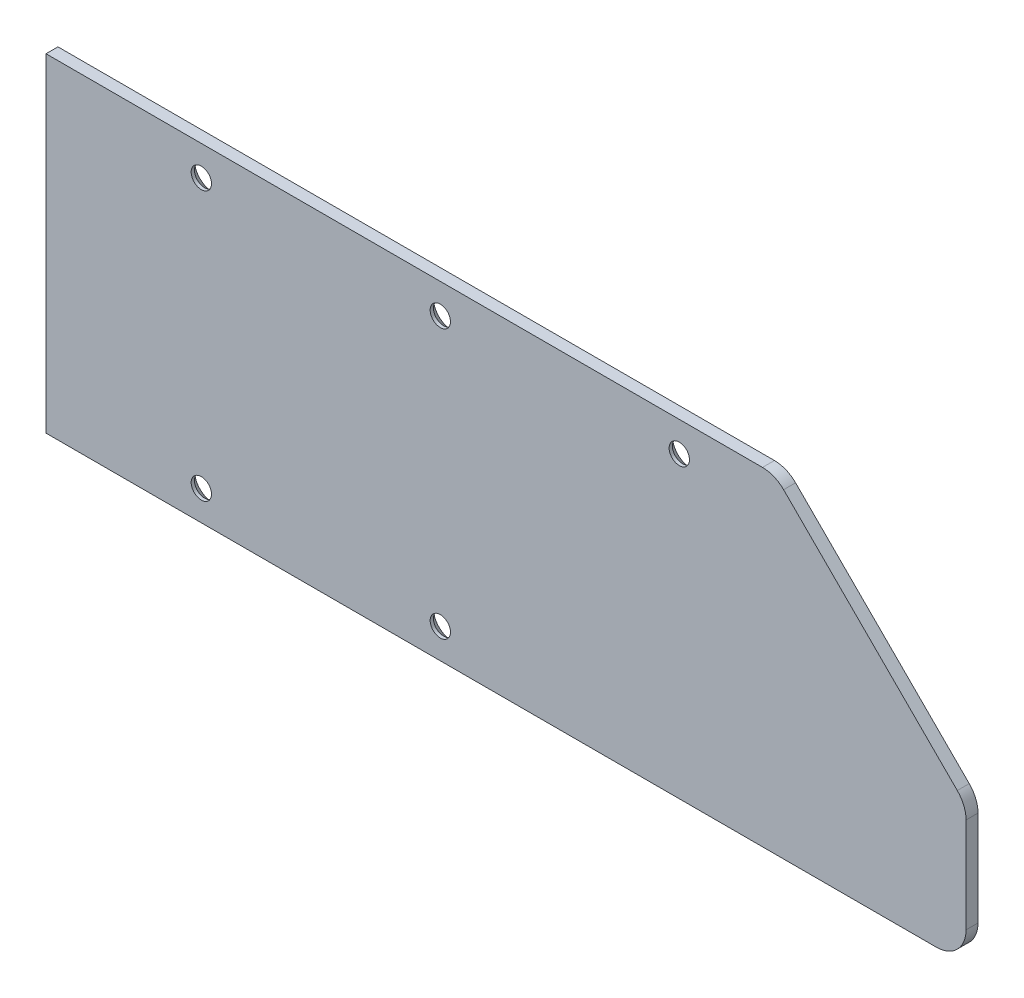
SolidWorks part; units mm, degrees
ref_plane "Face" through (0, 0, 0) normal (0, 0, 1) x (1, 0, 0)
ref_plane "Dessus" through (0, 0, 0) normal (0, 1, 0) x (1, 0, 0)
ref_plane "Profil" through (0, 0, 0) normal (1, 0, 0) x (0, 0, -1)
sketch "Esquisse1" plane through (0, 0, 0) normal (0, 0, 1) x (1, 0, 0)
  line L1 (0, 0) -> (154, 0)
  line L2 (0, 0) -> (0, 55)
  line L3 (0, 55) -> (154, 55)
  line L4 (154, 0) -> (154, 55)
  dimension "D1" = 154
  dimension "D2" = 55
extrude "Extrusion1" add sketch "Esquisse1" along normal blind 2
sketch "Esquisse2" plane through (0, 0, 2) normal (0, 0, 1) x (1, 0, 0)
  line L5 (122, 55) -> (154, 23)
  line L6 (154, 55) -> (0, 55) construction
  line L7 (154, 0) -> (154, 55) construction
  dimension "D1" = 32
  dimension "D2" = 45
extrude "Enlèv. mat.-Extru.1" cut sketch "Esquisse2" against normal through all and the other way through all
fillet "Congé1" radius 5 3 edges at (154, 23, 1) (154, 0, 1) (122, 55, 1)
hole_wizard "Fraisage pour vis à tête fraisée M31" positions "Esquisse4" profile "Esquisse3" countersink size "M3" standard "DIN"
sketch "Esquisse4" plane through (-0.4426, 12.1444, 0) normal (0, 0, 1) x (1, 0, 0)
  line L0 (0.4426, -12.1444) -> (149.4426, -12.1444) construction
  line L1 (0.4426, 42.8556) -> (0.4426, -12.1444) construction
  point P0 (26.4426, -7.1444)
  dimension "D1" = 5
  dimension "D2" = 26
sketch "Esquisse3" plane through (26, 5, 0) normal (1, 0, 0) x (0, 1, 0)
  line L0 (0, 0) -> (0, 2)
  line L1 (0, 2) -> (1.7, 2)
  line L2 (1.7, 2) -> (1.7, 1.45)
  line L3 (1.7, 1.45) -> (3.15, 0)
  line L5 (3.15, 0) -> (0, 0)
  line L6 (-1.7, 1.45) -> (-3.15, 0) construction
  line L11 (0, -6.35) -> (0, 107.95) construction
  dimension "Diamètre du perçage jusqu'au prochain" = 3.4
  dimension "Profondeur du perçage jusqu'au prochain" = 2
  dimension "Diamètre du fraisage entrant" = 6.3
  dimension "Angle du fraisage entrant" = 90
pattern_linear "Répétition linéaire1" count 3 spacing 40 along (1, 0, 0) count 2 spacing 45 along (0, 1, 0) of "Fraisage pour vis à tête fraisée M31"
